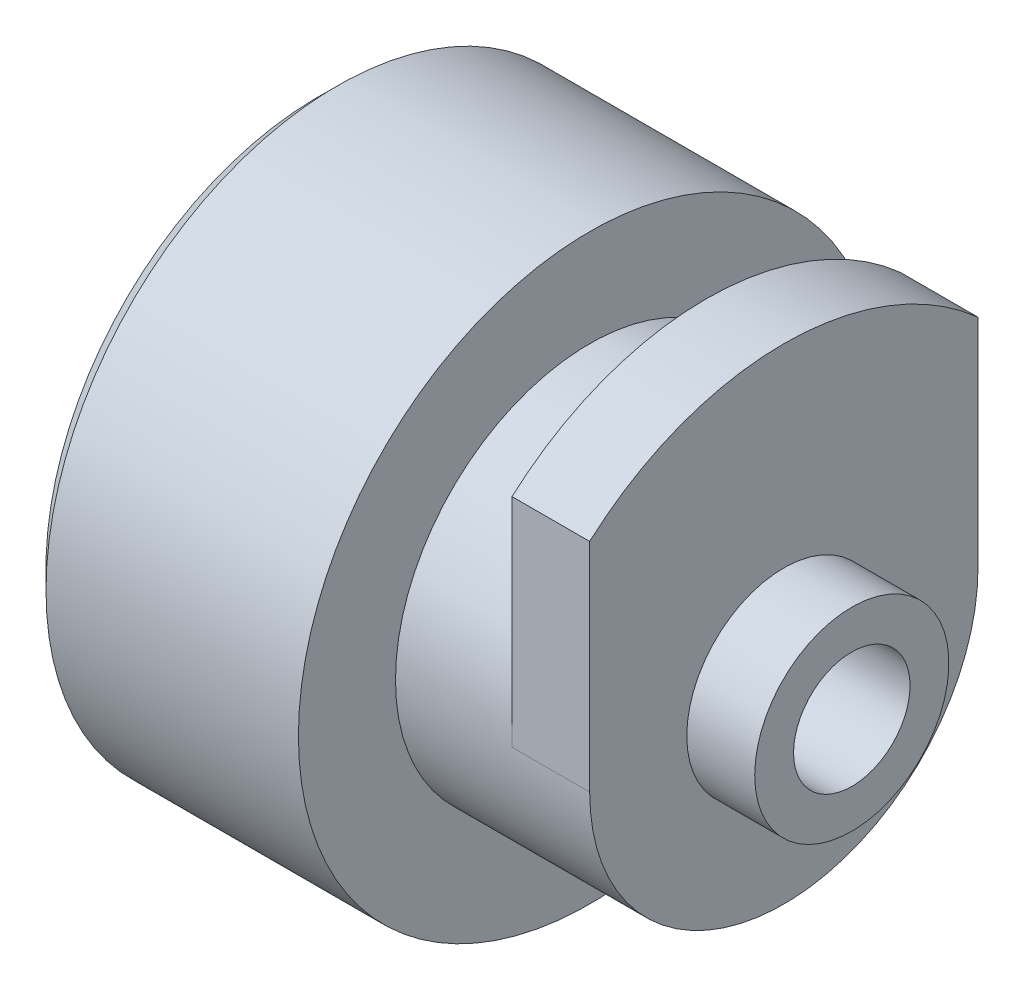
SolidWorks part; units mm, degrees
ref_plane "Front" through (0, 0, 0) normal (0, 0, 1) x (1, 0, 0)
ref_plane "Top" through (0, 0, 0) normal (0, 1, 0) x (1, 0, 0)
ref_plane "Right" through (0, 0, 0) normal (1, 0, 0) x (0, 0, -1)
sketch "Sketch1" plane through (0, 0, 0) normal (0, 1, 0) x (1, 0, 0)
  line L0 (0, 0) -> (27.5, 0)
  line L1 (27.5, 0) -> (27.5, 5)
  line L2 (27.5, 5) -> (24, 5)
  line L3 (24, 5) -> (24, 10)
  line L4 (24, 10) -> (14, 10)
  line L5 (14, 10) -> (14, 15)
  line L6 (14, 15) -> (0, 15)
  line L7 (0, 15) -> (0, 0)
revolve "Revolve1" add sketch "Sketch1" angle 360 about L0
sketch "Sketch2" plane through (0, 0, 0) normal (-1, 0, 0) x (0, 0, 1)
  circle A0 centre (0, 0) radius 10
extrude "Cut-Extrude1" cut sketch "Sketch2" against normal blind 5
sketch "Sketch3" plane through (5, 0, 0) normal (-1, 0, 0) x (0, 0, 1)
  circle A0 centre (0, 0) radius 3
extrude "Cut-Extrude2" cut sketch "Sketch3" against normal through all
chamfer "Chamfer1" distance 1 angle 45 1 edges at (0, 0, 15)
sketch "Sketch4" plane through (24, 0, 0) normal (1, 0, 0) x (0, 0, -1)
  line L1 (-10, 0) -> (-3, 0)
  line L2 (10, 0) -> (10, 11.1803)
  line L3 (-10, 0) -> (-10, 11.1803)
  line L4 (3, 0) -> (10, 0)
  circle A0 centre (0, 0) radius 10 construction
  arc A1 (10, 11.1803) -> (-10, 11.1803) centre (0, 0) ccw
  arc A2 (3, 0) -> (-3, 0) centre (0, 0) ccw
extrude "Extrude1" add sketch "Sketch4" against normal blind 4
